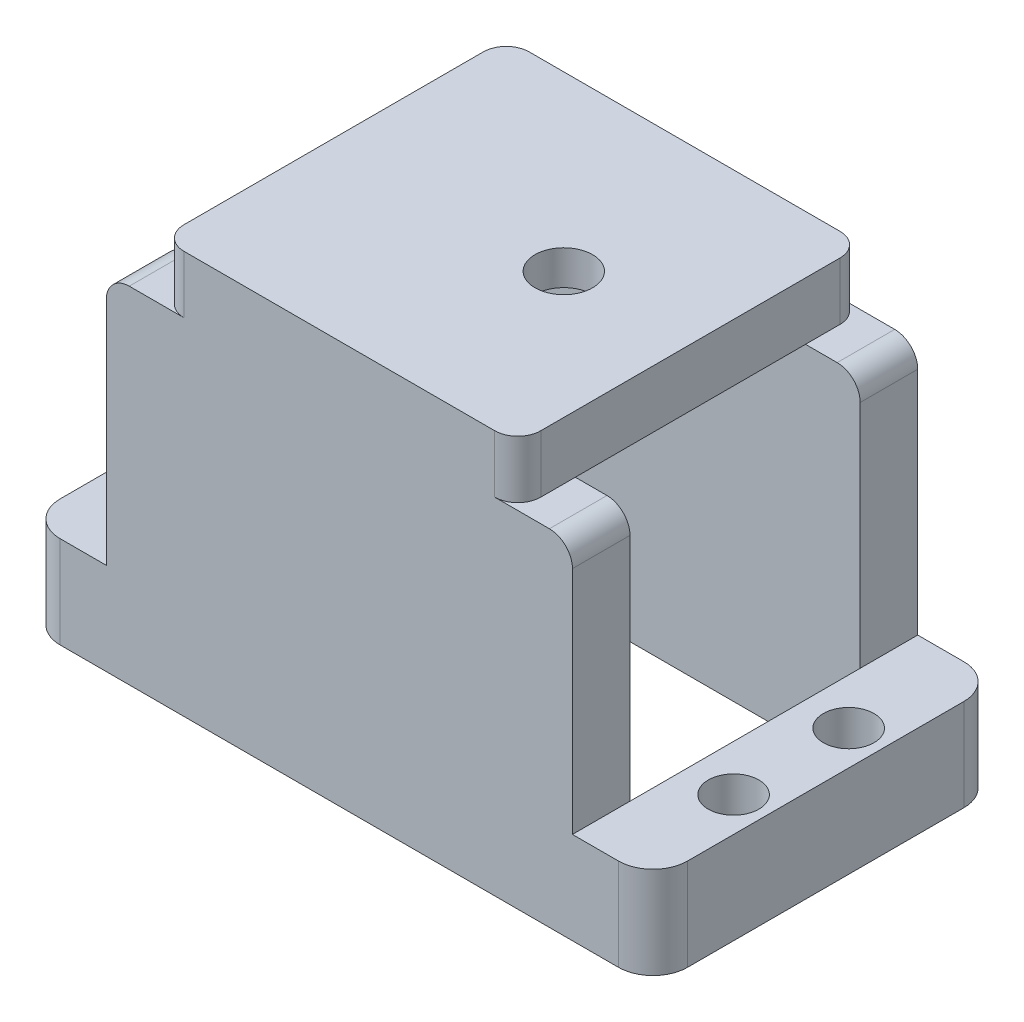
SolidWorks part; units mm, degrees
ref_plane "Ebene vorne" through (0, 0, 0) normal (0, 0, 1) x (1, 0, 0)
ref_plane "Ebene oben" through (0, 0, 0) normal (0, 1, 0) x (1, 0, 0)
ref_plane "Ebene rechts" through (0, 0, 0) normal (1, 0, 0) x (0, 0, -1)
sketch "Skizze1" plane through (0, 0, 0) normal (0, 1, 0) x (1, 0, 0)
  line L0 (0, -15) -> (54.5, -15) construction
  line L1 (0, 0) -> (54.5, 0)
  line L2 (0, 0) -> (0, -30)
  line L3 (0, -30) -> (54.5, -30)
  line L4 (54.5, 0) -> (54.5, -30)
  line L5 (27.25, 0) -> (27.25, -30) construction
  circle A0 centre (51.5, -10) radius 2.2
  circle A1 centre (51.5, -20) radius 2.2
  circle A2 centre (3, -20) radius 2.2
  circle A3 centre (3, -10) radius 2.2
  dimension "D3" = 4.4
  dimension "D1" = 54.5
  dimension "D2" = 30
  dimension "D4" = 5
  dimension "D5" = 3
extrude "Aufsatz-Linear austragen3" add sketch "Skizze1" along normal blind 30
sketch "Skizze3" plane through (0, 0, 30) normal (0, 0, 1) x (1, 0, 0)
  line L0 (27.25, 30) -> (27.25, 0) construction
  line L1 (54.5, 30) -> (47.5, 30)
  line L2 (54.5, 30) -> (54.5, 8)
  line L3 (54.5, 8) -> (47.5, 8)
  line L4 (47.5, 30) -> (47.5, 8)
  line L5 (0, 30) -> (54.5, 30) construction
  line L6 (0, 0) -> (54.5, 0) construction
  line L8 (0, 30) -> (7, 30)
  line L9 (0, 30) -> (0, 8)
  line L10 (0, 8) -> (7, 8)
  line L11 (7, 30) -> (7, 8)
  dimension "D1" = 22
  dimension "D2" = 7
  dimension "D3" = 7
  dimension "D4" = 22
extrude "Schnitt-Linear austragen2" cut sketch "Skizze3" against normal through all
sketch "Skizze4" plane through (0, 0, 0) normal (0, -1, 0) x (-1, 0, 0)
  line L0 (0, -30) -> (-54.5, -30) construction
  line L1 (-7, -25) -> (-47.5, -25)
  line L2 (-7, -25) -> (-7, -5)
  line L3 (-7, -5) -> (-47.5, -5)
  line L4 (-47.5, -25) -> (-47.5, -5)
  line L5 (0, 0) -> (0, -30) construction
  dimension "D1" = 40.5
  dimension "D2" = 20
  dimension "D3" = 5
  dimension "D4" = 7
extrude "Schnitt-Linear austragen5" cut sketch "Skizze4" against normal through all
sketch "Skizze6" plane through (0, 30, 0) normal (0, 1, 0) x (1, 0, 0)
  line L0 (47.5, 0) -> (7, 0) construction
  line L1 (11.75, 0) -> (42.75, 0)
  line L2 (11.75, 0) -> (11.75, -30)
  line L3 (11.75, -30) -> (42.75, -30)
  line L4 (42.75, 0) -> (42.75, -30)
  line L5 (7, -30) -> (47.5, -30) construction
  line L6 (7, 0) -> (7, -5) construction
  dimension "D1" = 31
  dimension "D2" = 4.75
extrude "Aufsatz-Linear austragen5" add sketch "Skizze6" along normal blind 5
sketch "Skizze7" plane through (0, 35, 0) normal (0, 1, 0) x (1, 0, 0)
  line L0 (42.75, 0) -> (11.75, 0) construction
  line L2 (11.75, 0) -> (11.75, -30) construction
  circle A0 centre (31.75, -15) radius 2.5001
  dimension "D1" = 5.0001
  dimension "D2" = 15
  dimension "25" = 20
extrude "Schnitt-Linear austragen7" cut sketch "Skizze7" against normal through all
sketch "Skizze8" plane through (0, 30, 0) normal (0, -1, 0) x (-1, 0, 0)
  circle A0 centre (-31.75, -15) radius 6.1
  dimension "D1" = 12.2
extrude "Schnitt-Linear austragen8" cut sketch "Skizze8" against normal blind 2
fillet "Verrundung1" radius 3 4 edges at (0, 4, 0) (0, 4, 30) (54.5, 4, 0) (54.5, 4, 30)
fillet "Verrundung2" radius 2 8 edges at (42.75, 32.5, 30) (42.75, 32.5, 0) (11.75, 32.5, 0) (11.75, 32.5, 30) (47.5, 30, 2.5) (47.5, 30, 27.5) (7, 30, 27.5) (7, 30, 2.5)
